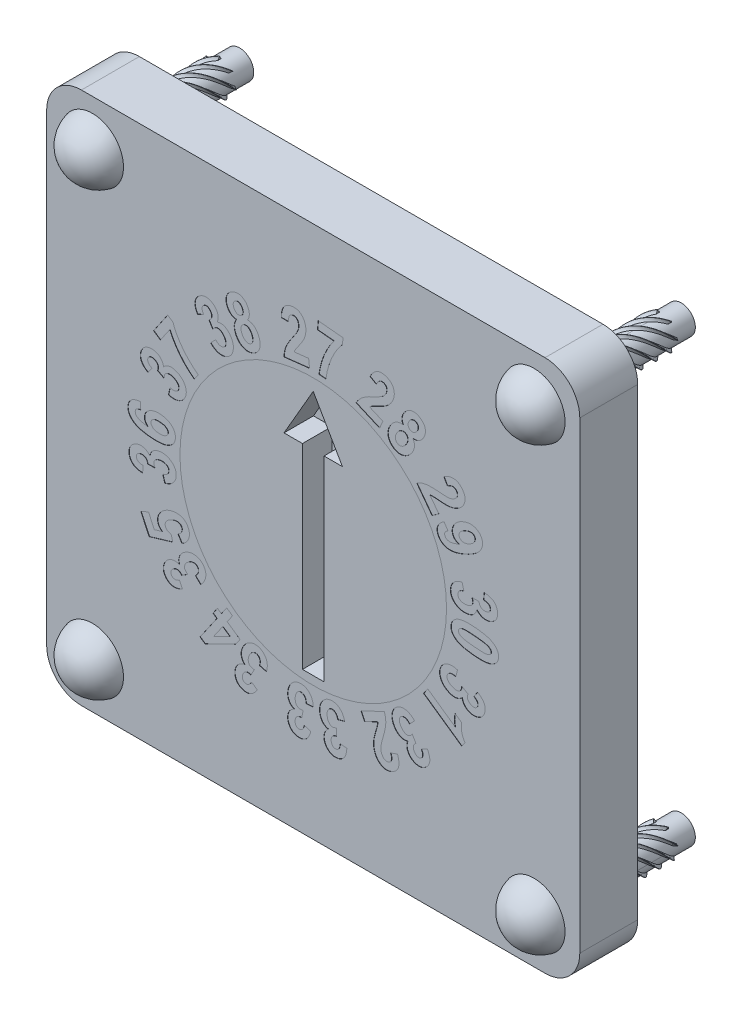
SolidWorks part; units mm, degrees
ref_plane "Front Plane" through (0, 0, 0) normal (0, 0, 1) x (1, 0, 0)
ref_plane "Top Plane" through (0, 0, 0) normal (0, 1, 0) x (1, 0, 0)
ref_plane "Right Plane" through (0, 0, 0) normal (1, 0, 0) x (0, 0, -1)
sketch "Sketch1" plane through (0, 0, 0) normal (0, 0, 1) x (1, 0, 0)
  line L1 (-20, 23) -> (20, 23)
  line L2 (-23, 20) -> (-23, -20)
  line L3 (-20, -23) -> (20, -23)
  line L4 (23, 20) -> (23, -20)
  line L5 (-23, 23) -> (23, -23) construction
  line L6 (-23, -23) -> (23, 23) construction
  arc A0 (20, 23) -> (23, 20) centre (20, 20) cw
  arc A1 (-23, -20) -> (-20, -23) centre (-20, -20) ccw
  arc A2 (-20, 23) -> (-23, 20) centre (-20, 20) ccw
  arc A3 (20, -23) -> (23, -20) centre (20, -20) ccw
  point P0 (0, 0)
  dimension "D1" = 3
  dimension "D2" = 46
  dimension "D3" = 46
extrude "Boss-Extrude1" add sketch "Sketch1" along normal blind 5
sketch "Sketch5" plane through (0, 0, 5) normal (0, 0, 1) x (1, 0, 0)
  line L0 (-19.5, 19.5) -> (-19.05, 19.05) construction
  line L1 (-18.2626, 20.7374) -> (-17.8126, 20.2874)
  line L2 (-20.7374, 18.2626) -> (-20.2874, 17.8126)
  line L3 (0, 20.2802) -> (0, 0) construction
  line L4 (0, 0) -> (-26.2232, 0) construction
  line L5 (19.5, 19.5) -> (19.05, 19.05) construction
  line L6 (18.2626, 20.7374) -> (17.8126, 20.2874)
  line L7 (20.7374, 18.2626) -> (20.2874, 17.8126)
  line L8 (19.5, -19.5) -> (19.05, -19.05) construction
  line L9 (18.2626, -20.7374) -> (17.8126, -20.2874)
  line L10 (20.7374, -18.2626) -> (20.2874, -17.8126)
  line L11 (-19.5, -19.5) -> (-19.05, -19.05) construction
  line L12 (-18.2626, -20.7374) -> (-17.8126, -20.2874)
  line L13 (-20.7374, -18.2626) -> (-20.2874, -17.8126)
  arc A0 (-18.2626, 20.7374) -> (-20.7374, 18.2626) centre (-19.5, 19.5) ccw
  arc A1 (-20.2874, 17.8126) -> (-17.8126, 20.2874) centre (-19.05, 19.05) ccw
  arc A2 (18.2626, 20.7374) -> (20.7374, 18.2626) centre (19.5, 19.5) cw
  arc A3 (20.2874, 17.8126) -> (17.8126, 20.2874) centre (19.05, 19.05) cw
  arc A4 (18.2626, -20.7374) -> (20.7374, -18.2626) centre (19.5, -19.5) ccw
  arc A5 (20.2874, -17.8126) -> (17.8126, -20.2874) centre (19.05, -19.05) ccw
  arc A6 (-18.2626, -20.7374) -> (-20.7374, -18.2626) centre (-19.5, -19.5) cw
  arc A7 (-20.2874, -17.8126) -> (-17.8126, -20.2874) centre (-19.05, -19.05) cw
  point P3 (-19.275, 19.275)
  point P14 (19.275, 19.275)
  point P21 (19.275, -19.275)
  point P28 (-19.275, -19.275)
  dimension "D1" = 1.75
  dimension "D2" = 38.1
  dimension "D3" = 38.1
  dimension "D4" = 39
  dimension "D5" = 39
extrude "Slots" cut sketch "Sketch5" against normal through all
sketch "Sketch13" plane through (0, 0, 5) normal (0, 0, 1) x (1, 0, 0)
  circle A0 centre (0, 0) radius 11.5
  dimension "D1" = 23
extrude "Cut-Extrude3" cut sketch "Sketch13" against normal through all
sketch "Sketch14" plane through (0, 0, 5) normal (0, 0, 1) x (1, 0, 0)
  line L0 (0, 0) -> (0, 18.9191) construction
  line L1 (0, 0) -> (10.2285, 15.9158) construction
  line L2 (0, 0) -> (17.2094, 7.8593) construction
  line L3 (0, 0) -> (18.7266, -2.6925) construction
  line L4 (0, 0) -> (14.2981, -12.3894) construction
  line L5 (0, 0) -> (5.3301, -18.1528) construction
  line L6 (0, 0) -> (-5.3301, -18.1528) construction
  line L7 (0, 0) -> (-14.2981, -12.3894) construction
  line L8 (0, 0) -> (-18.7266, -2.6925) construction
  line L9 (0, 0) -> (-17.2094, 7.8593) construction
  line L10 (0, 0) -> (-10.2285, 15.9158) construction
  arc A0 (-2.6231, 11.7808) -> (-3.109, 11.662) centre (0, 0) cw construction
  text T0 "27 28 29 30 31 32 33 34 35 36 37 38" font "Arial Narrow" height 4
  point P16 (0, 0)
  dimension "D1" = 11
extrude "YEARS" cut sketch "Sketch14" against normal blind 0.0254
imported_body "Imported1"
move or copy body "Body-Move/Copy2" bodies to move or copy 121 placed by mates yes parameters "D1"=0, "D2"=0, "D3"=0
imported_body "Imported1_#4_.500_U-Drive Screw"
move or copy body "Body-Move/Copy5" bodies to move or copy 124 copy no translate (-27.7239, 22.7716, 15.1258) parameters "D1"=0, "D2"=0, "D3"=0
move or copy body "Body-Move/Copy4" bodies to move or copy 125 placed by mates yes parameters "D1"=0, "D2"=0, "D3"=0
pattern_circular "CirPattern1" count 4 over 360 about axis through (0, 0, 5) along (0, 0, 1)
